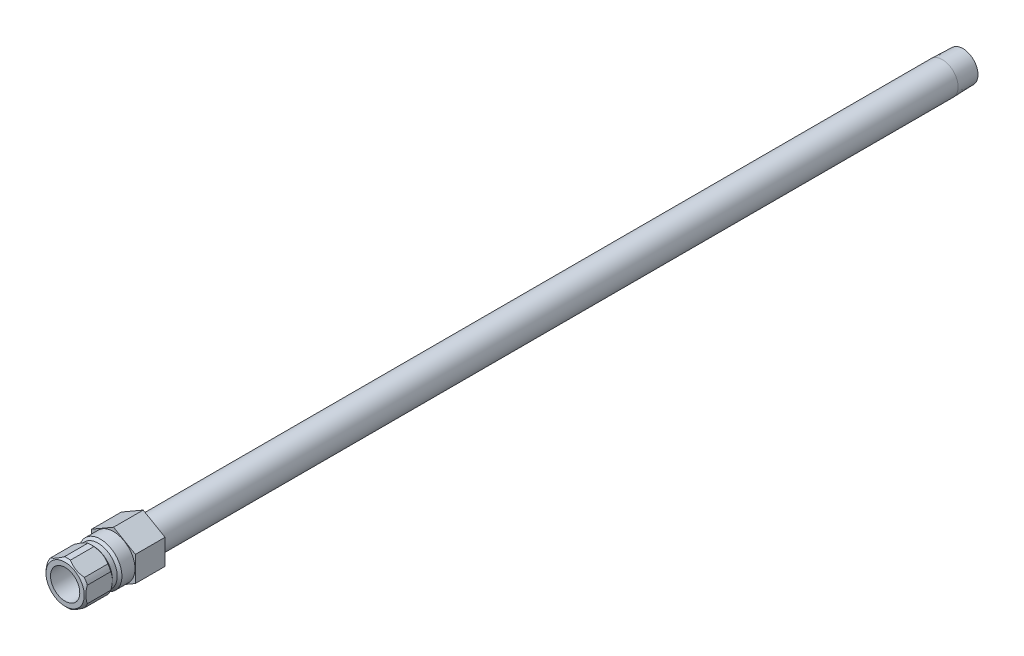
SolidWorks part; units mm, degrees
ref_plane "Front Plane" through (0, 0, 0) normal (0, 0, 1) x (1, 0, 0)
ref_plane "Top Plane" through (0, 0, 0) normal (0, 1, 0) x (1, 0, 0)
ref_plane "Right Plane" through (0, 0, 0) normal (1, 0, 0) x (0, 0, -1)
sketch "Sketch1" plane through (0, 0, 0) normal (1, 0, 0) x (0, 0, -1)
  line L0 (9.652, 0) -> (-18.923, 0) construction
  line L1 (-15.748, 4.7625) -> (-15.748, 6.223)
  line L2 (-6.604, 6.223) -> (-6.604, 0) construction
  line L3 (-14.986, 6.985) -> (-7.366, 6.985)
  line L4 (9.652, 5.1435) -> (9.652, 0) construction
  line L5 (-6.604, 6.223) -> (-5.0165, 6.223)
  line L6 (-4.2545, 6.985) -> (9.652, 6.985)
  line L7 (9.652, 6.985) -> (9.652, 5.1435)
  line L8 (-6.604, 6.223) -> (-7.366, 6.985)
  line L9 (-5.0165, 6.223) -> (-4.2545, 6.985)
  line L10 (-15.748, 6.223) -> (-14.986, 6.985)
  line L11 (-15.748, 4.7625) -> (-3.556, 4.7625)
  line L12 (9.652, 5.1435) -> (269.6718, 5.1435)
  line L13 (269.6718, 5.1435) -> (276.352, 4.9347)
  line L14 (276.352, 4.9347) -> (276.352, 3.4163)
  line L15 (-3.556, 4.7625) -> (-3.556, 6.985) construction
  line L16 (9.652, 6.731) -> (9.652, 0) construction
  line L17 (-3.556, 4.7625) -> (-2.8402, 3.4163)
  line L19 (-2.8402, 3.4163) -> (276.352, 3.4163)
  dimension "D2" = 1.5875
  dimension "D3" = 0.762
  dimension "D4" = 45
  dimension "D5" = 9.144
  dimension "D6" = 45
  dimension "D7" = 1.79
  dimension "D8" = 6.6802
  dimension "D9" = 292.1
  dimension "D10" = 3.175
  dimension "D11" = 9.525
  dimension "D12" = 10.287
  dimension "D13" = 25.4
  dimension "D14" = 13.97
  dimension "D15" = 6.8326
  dimension "D16" = 15.748
  dimension "D17" = 12.192
  dimension "D18" = 118
revolve "Revolve1" add sketch "Sketch1" angle 360 about L0
sketch "Sketch2" plane through (0, 0, 0) normal (0, 0, 1) x (1, 0, 0)
  line L1 (-7.112, 4.1061) -> (-7.112, -4.1061)
  line L2 (-7.112, -4.1061) -> (0, -8.2122)
  line L3 (0, -8.2122) -> (7.112, -4.1061)
  line L4 (7.112, -4.1061) -> (7.112, 4.1061)
  line L5 (7.112, 4.1061) -> (0, 8.2122)
  line L6 (0, 8.2122) -> (-7.112, 4.1061)
  circle A0 centre (0, 0) radius 7.112 construction
  circle A1 centre (0, 0) radius 4.7625 construction
  circle A2 centre (0, 0) radius 4.7625
  dimension "D1" = 14.224
extrude "Boss-Extrude1" add sketch "Sketch2" against normal up to vertex (9.652 mm away)
sketch "Sketch3" plane through (0, 0, 0) normal (0, 0, 1) x (1, 0, 0)
  line L1 (6.477, 3.7395) -> (0, 7.479)
  line L2 (0, 7.479) -> (-6.477, 3.7395)
  line L3 (-6.477, 3.7395) -> (-6.477, -3.7395)
  line L4 (-6.477, -3.7395) -> (0, -7.479)
  line L5 (0, -7.479) -> (6.477, -3.7395)
  line L6 (6.477, -3.7395) -> (6.477, 3.7395)
  circle A0 centre (0, 0) radius 6.477 construction
  dimension "D1" = 12.954
extrude "Cut-Extrude1" cut sketch "Sketch3" along normal through all from vertex at 6.604 flip side to cut
